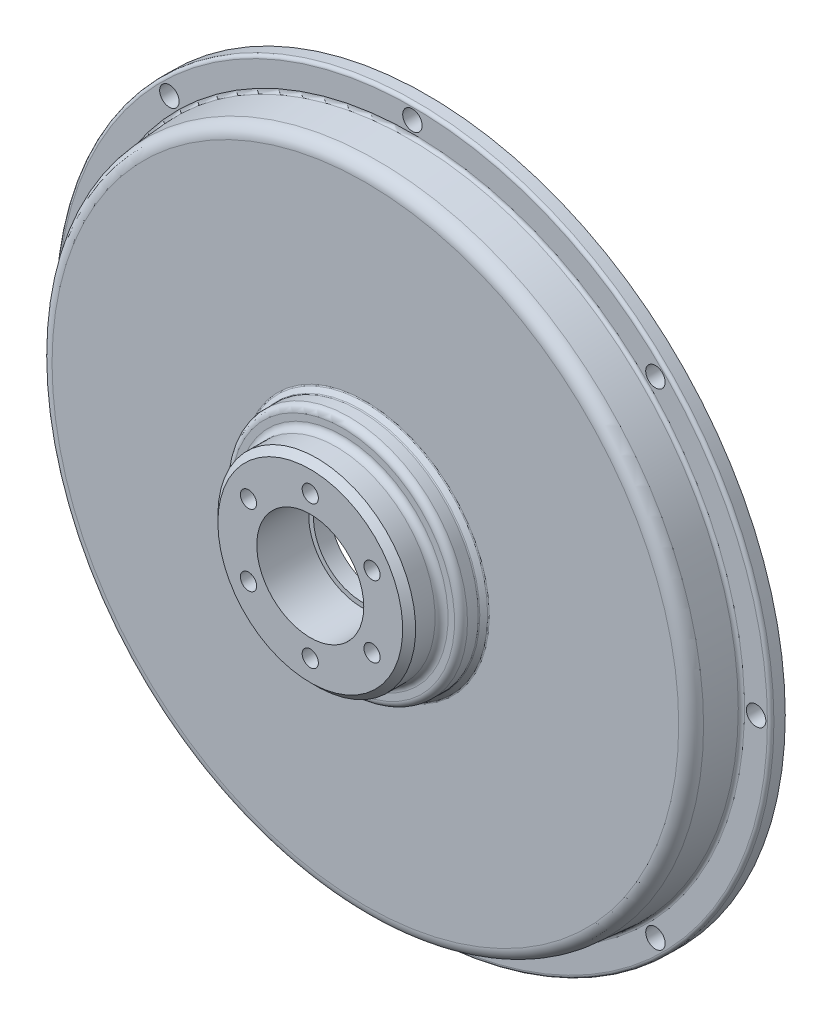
SolidWorks part; units mm, degrees
ref_plane "Спереди" through (0, 0, 0) normal (0, 0, 1) x (1, 0, 0)
ref_plane "Сверху" through (0, 0, 0) normal (0, 1, 0) x (1, 0, 0)
ref_plane "Справа" through (0, 0, 0) normal (1, 0, 0) x (0, 0, -1)
sketch "Эскиз1" plane through (0, 0, 0) normal (0, 1, 0) x (1, 0, 0)
  line L0 (0, 0) -> (-110.5, 0) construction
  line L1 (-110.5, 0) -> (-110.5, -3.5)
  line L2 (-109.5, -4.5) -> (-102.4224, -4.5)
  line L3 (-101.5, -4.5) -> (-101.5, -19) construction
  line L4 (-101.5, -19) -> (-36.5, -19) construction
  line L5 (-110.5, 0) -> (0, 0)
  line L6 (-36.5, -19) -> (-36.5, -36) construction
  line L7 (-36.5, -36) -> (0, -36) construction
  line L8 (0, 0) -> (0, -36) construction
  line L9 (-36.5, -20.5) -> (-36.5, -24)
  line L10 (-34.5, -26) -> (-32.5, -26)
  line L11 (-30.5, -28) -> (-30.5, -34)
  line L12 (-28.5, -36) -> (0, -36)
  line L13 (-101.4257, -5.4194) -> (-100.6249, -15.3224)
  line L14 (-96.6379, -19) -> (-38, -19)
  line L15 (-38, -19) -> (-36.5, -20.5)
  line L16 (-30.5, -34) -> (-28.5, -36)
  line L17 (0, 0) -> (0, -36)
  arc A0 (-100.6249, -15.3224) -> (-96.6379, -19) centre (-96.6379, -15) ccw
  arc A1 (-102.4224, -4.5) -> (-101.4257, -5.4194) centre (-102.4224, -5.5) cw
  arc A2 (-32.5, -26) -> (-30.5, -28) centre (-32.5, -28) cw
  arc A3 (-36.5, -24) -> (-34.5, -26) centre (-34.5, -24) ccw
  arc A4 (-110.5, -3.5) -> (-109.5, -4.5) centre (-109.5, -3.5) ccw
  point P12 (-30.5, -36)
  point P15 (-100.3276, -19)
  point P25 (-36.5, -26)
  point P30 (-110.5, -4.5)
  dimension "D8" = 4
  dimension "D9" = 1
  dimension "D10" = 2
  dimension "D11" = 1
  dimension "D1" = 110.5
  dimension "D2" = 36.5
  dimension "D3" = 14.5
  dimension "D4" = 9
  dimension "D5" = 4.5
  dimension "D6" = 17
  dimension "D7" = 30.5
revolve "Повернуть1" add sketch "Эскиз1" angle 360 about L17
fillet "Скругление1" radius 0.5 2 edges at (-38, 0, 19) (-36.5, 0, 20.5)
sketch "Эскиз2" plane through (0, 0, 4.5) normal (0, 0, 1) x (1, 0, 0)
  circle A0 centre (0, 0) radius 106 construction
  circle A1 centre (0, 106) radius 3
  circle A2 centre (74.9533, 74.9533) radius 3
  circle A3 centre (106, 0) radius 3
  circle A4 centre (74.9533, -74.9533) radius 3
  circle A5 centre (0, -106) radius 3
  circle A6 centre (-74.9533, -74.9533) radius 3
  circle A7 centre (-106, 0) radius 3
  circle A8 centre (-74.9533, 74.9533) radius 3
  point P22 (0, 0)
  dimension "D1" = 212
  dimension "D2" = 6
  dimension "D3" = 8
extrude "Вырез-Вытянуть1" cut sketch "Эскиз2" against normal blind 10
sketch "Эскиз3" plane through (0, 0, 36) normal (0, 0, 1) x (1, 0, 0)
  circle A0 centre (0, 0) radius 16.5
  dimension "D1" = 33
extrude "Вырез-Вытянуть2" cut sketch "Эскиз3" against normal blind 16
sketch "Эскиз4" plane through (0, 0, 36) normal (0, 0, 1) x (1, 0, 0)
  circle A0 centre (0, 0) radius 22 construction
  circle A1 centre (0, 22) radius 2.5
  circle A2 centre (19.0526, 11) radius 2.5
  circle A3 centre (19.0526, -11) radius 2.5
  circle A4 centre (0, -22) radius 2.5
  circle A5 centre (-19.0526, -11) radius 2.5
  circle A6 centre (-19.0526, 11) radius 2.5
  point P18 (0, 0)
  dimension "D1" = 44
  dimension "D2" = 5
  dimension "D3" = 6
extrude "Вырез-Вытянуть3" cut sketch "Эскиз4" against normal blind 15
sketch "Эскиз5" plane through (0, 0, 0) normal (0, 0, -1) x (-1, 0, 0)
  circle A0 centre (0, 0) radius 95
  dimension "D1" = 190
extrude "Вырез-Вытянуть4" cut sketch "Эскиз5" against normal blind 15
sketch "Эскиз6" plane through (0, 0, 20) normal (0, 0, 1) x (1, 0, 0)
  circle A0 centre (0, 0) radius 15
  dimension "D1" = 30
extrude "Вырез-Вытянуть5" cut sketch "Эскиз6" against normal blind 15
